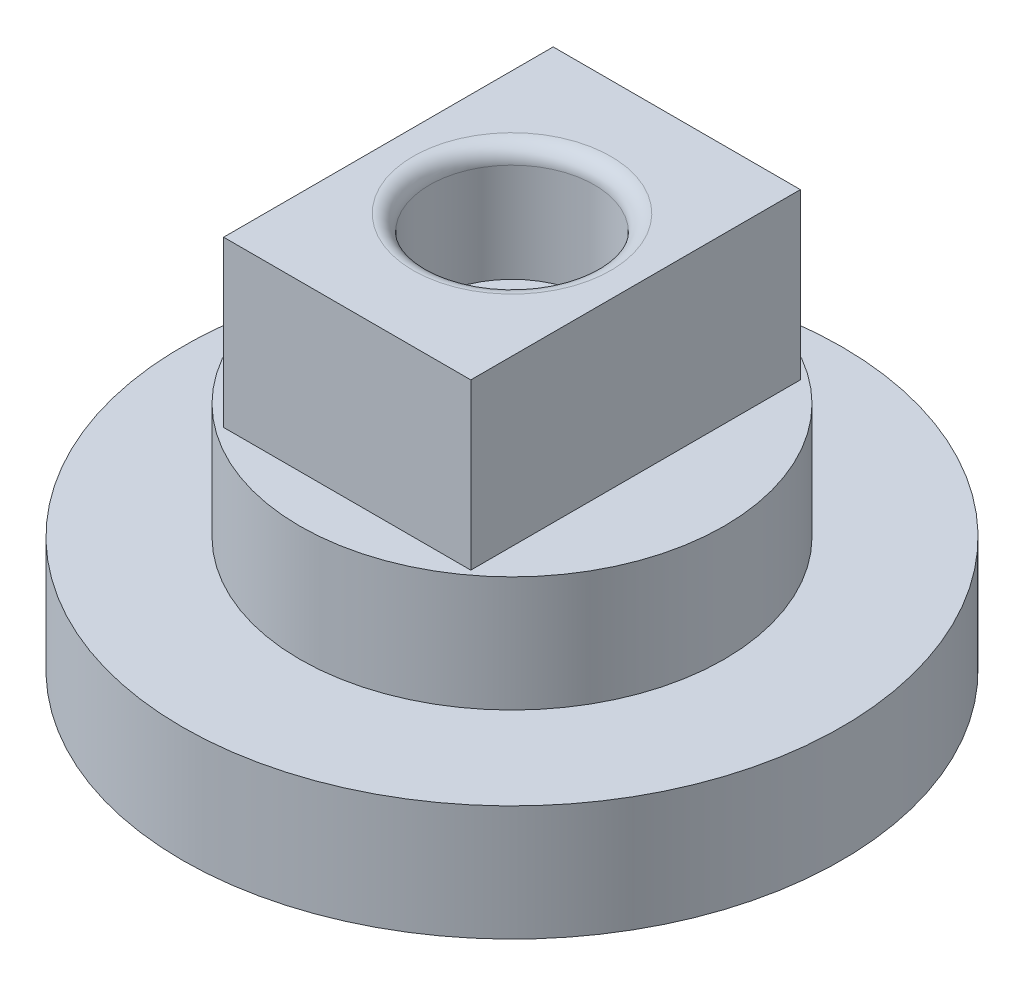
SolidWorks part; units mm, degrees
ref_plane "Ebene vorne" through (0, 0, 0) normal (0, 0, 1) x (1, 0, 0)
ref_plane "Ebene oben" through (0, 0, 0) normal (0, 1, 0) x (1, 0, 0)
ref_plane "Ebene rechts" through (0, 0, 0) normal (1, 0, 0) x (0, 0, -1)
sketch "Skizze1" plane through (0, 0, 0) normal (0, 1, 0) x (1, 0, 0)
  circle A0 centre (0, 0) radius 20
  dimension "D1" = 40
extrude "Aufsatz-Linear austragen1" add sketch "Skizze1" along normal blind 7
sketch "Skizze3" plane through (0, 7, 0) normal (0, 1, 0) x (1, 0, 0)
  circle A0 centre (0, 0) radius 12.875
  dimension "D1" = 25.75
extrude "Aufsatz-Linear austragen2" add sketch "Skizze3" along normal blind 7
sketch "Skizze4" plane through (0, 0, 0) normal (0, -1, 0) x (1, 0, 0)
  circle A0 centre (0, 0) radius 15
  dimension "D1" = 30
sketch "Skizze5" plane through (0, 0, 0) normal (0, -1, 0) x (-1, 0, 0)
  circle A0 centre (0, -15) radius 3.5
  circle A1 centre (0, 0) radius 15 construction
  circle A2 centre (-12.9904, 7.5) radius 3.5
  circle A3 centre (12.9904, 7.5) radius 3.5
  point P11 (0, 0)
  dimension "D1" = 7
  dimension "D2" = 3
sketch "Skizze7" plane through (0, 14, 0) normal (0, 1, 0) x (1, 0, 0)
  line L1 (-7.5, 10) -> (7.5, 10)
  line L2 (-7.5, 10) -> (-7.5, -10)
  line L3 (-7.5, -10) -> (7.5, -10)
  line L4 (7.5, 10) -> (7.5, -10)
  dimension "D1" = 15
  dimension "D2" = 7.5
  dimension "D3" = 20
  dimension "D4" = 10
extrude "Aufsatz-Linear austragen3" add sketch "Skizze7" along normal blind 10
sketch "Skizze8" plane through (0, 24, 0) normal (0, 1, 0) x (1, 0, 0)
  circle A0 centre (0, 0) radius 5
extrude "Schnitt-Linear austragen2" cut sketch "Skizze8" against normal blind 7 contours A0
fillet "Verrundung2" radius 1 1 edges at (0, 24, 5)
sketch "Skizze9" plane through (0, 0, 0) normal (0, -1, 0) x (1, 0, 0)
  circle A0 centre (0, 0) radius 5
  dimension "D1" = 10
extrude "Schnitt-Linear austragen3" cut sketch "Skizze9" against normal blind 3
extrude "Schnitt-Linear austragen4" cut sketch "Skizze5" against normal blind 5
